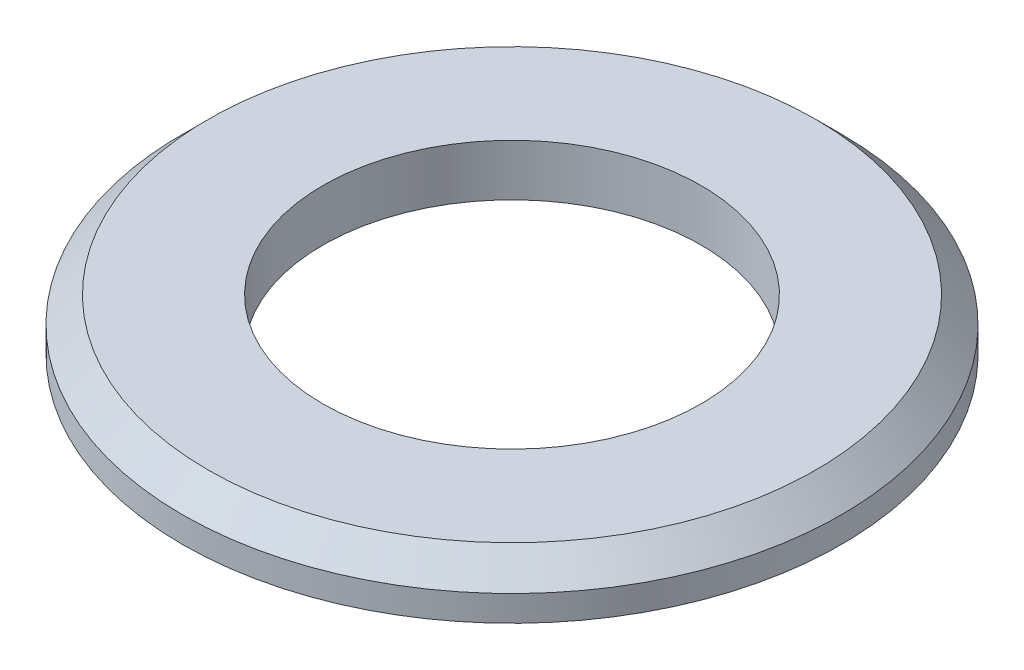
SolidWorks part; units mm, degrees
ref_plane "Front" through (0, 0, 0) normal (0, 0, 1) x (1, 0, 0)
ref_plane "Top" through (0, 0, 0) normal (0, 1, 0) x (1, 0, 0)
ref_plane "Right" through (0, 0, 0) normal (1, 0, 0) x (0, 0, -1)
sketch "Sketch1" plane through (0, 0, 0) normal (0, 1, 0) x (1, 0, 0)
  circle A0 centre (0, 0) radius 33
  circle A1 centre (0, 0) radius 57.5
extrude "Extrude1" add sketch "Sketch1" along normal blind 9
chamfer "Chamfer1" distance 4.5 1 edges at (0, 9, 57.5)
